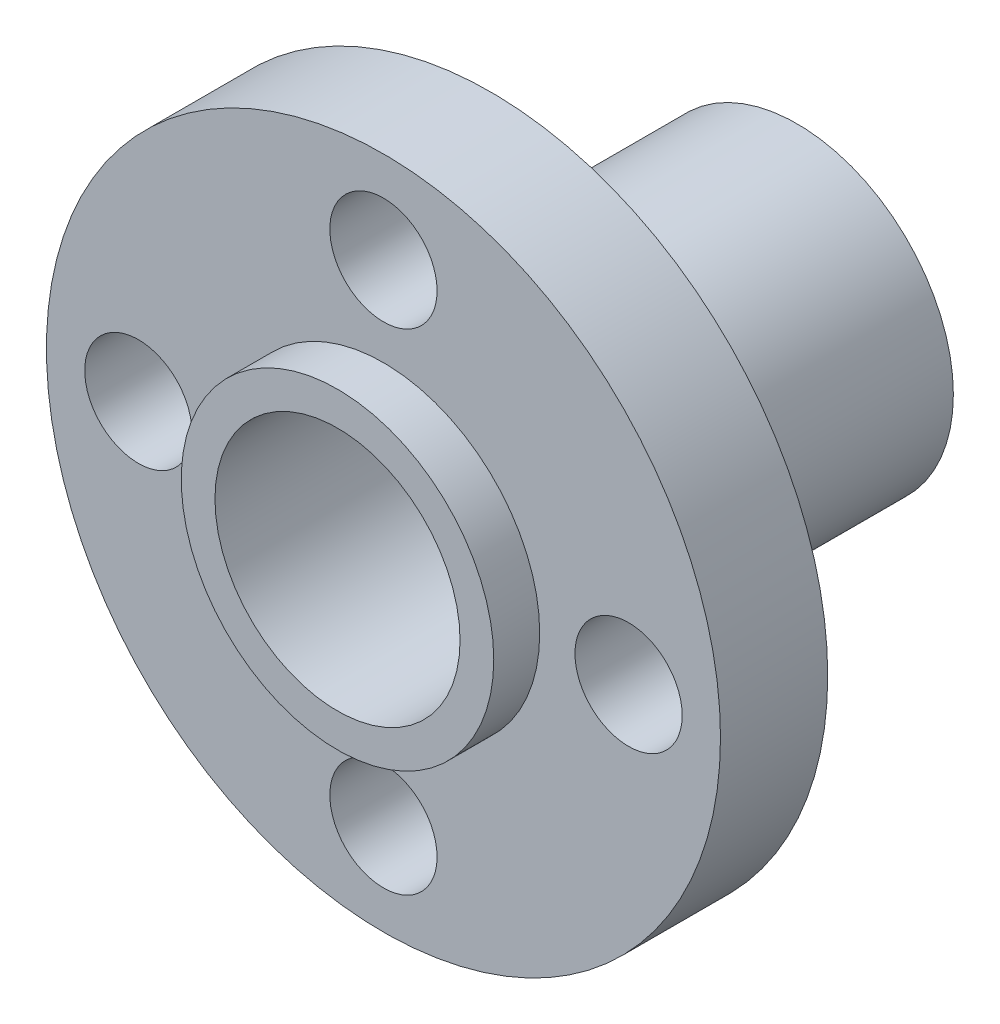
SolidWorks part; units mm, degrees
ref_plane "Front Plane" through (0, 0, 0) normal (0, 0, 1) x (1, 0, 0)
ref_plane "Top Plane" through (0, 0, 0) normal (0, 1, 0) x (1, 0, 0)
ref_plane "Right Plane" through (0, 0, 0) normal (1, 0, 0) x (0, 0, -1)
sketch "Sketch1" plane through (0, 0, 0) normal (0, 0, 1) x (1, 0, 0)
  circle A0 centre (0, 0) radius 11
  circle A1 centre (0, 0) radius 8
  circle A2 centre (0, 8) radius 1.75
  circle A3 centre (8, 0) radius 1.75
  circle A4 centre (0, -8) radius 1.75
  circle A5 centre (-8, 0) radius 1.75
  circle A6 centre (0, 0) radius 4
  point P15 (0, 0)
  dimension "D1" = 22
  dimension "D2" = 16
  dimension "D3" = 3.5
  dimension "D5" = 8
  dimension "D4" = 4
extrude "Boss-Extrude1" add sketch "Sketch1" along normal blind 3.5 contours A0 A5 A1 A2 A3 A4 | A5 A1 A4 A3 A2 A6
sketch "Sketch2" plane through (0, 0, 0) normal (0, 0, -1) x (-1, 0, 0)
  circle A0 centre (0, 0) radius 5.1
  circle A1 centre (0, 0) radius 4
  dimension "D1" = 10.2
  dimension "D2" = 8
extrude "Boss-Extrude2" add sketch "Sketch2" along normal blind 10
sketch "Sketch3" plane through (0, 0, 3.5) normal (0, 0, 1) x (1, 0, 0)
  circle A0 centre (0, 0) radius 5.1
  circle A1 centre (0, 0) radius 4
  dimension "D1" = 10.2
  dimension "D2" = 8
extrude "Boss-Extrude3" add sketch "Sketch3" along normal blind 1.5
